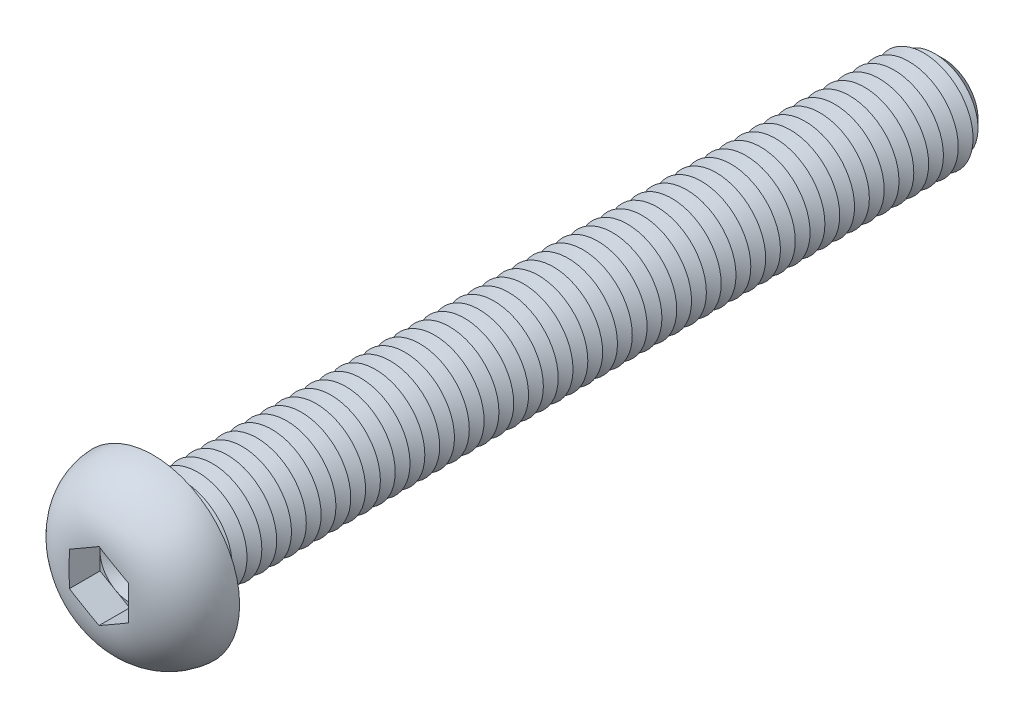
SolidWorks part; units mm, degrees
ref_plane "Front Plane" through (0, 0, 0) normal (0, 0, 1) x (1, 0, 0)
ref_plane "Top Plane" through (0, 0, 0) normal (0, 1, 0) x (1, 0, 0)
ref_plane "Right Plane" through (0, 0, 0) normal (1, 0, 0) x (0, 0, -1)
sketch "Sketch1" plane through (0, 0, 0) normal (1, 0, 0) x (0, 0, -1)
  line L0 (-47.9342, 0) -> (60.3146, 0) construction
sketch "Sketch2" plane through (0, 0, 0) normal (1, 0, 0) x (0, 0, -1)
  line L0 (0, 0) -> (-5.5, 0)
  line L1 (-47.9342, 0) -> (60.3146, 0) construction
  line L2 (-5.5, 0) -> (-5.5, 2.9578)
  line L3 (0, 8.75) -> (0, 0)
  arc A0 (-5.5, 2.9578) -> (0, 8.75) centre (0.3, 2.9578) cw
  dimension "D1" = 5.8
  dimension "D2" = 5.5
  dimension "D3" = 8.75
revolve "Revolve1" add sketch "Sketch2" angle 360 about L0
sketch "Sketch3" plane through (0, 0, 5.5) normal (0, 0, 1) x (1, 0, 0)
  line L1 (0, 3.4641) -> (-3, 1.7321)
  line L2 (-3, 1.7321) -> (-3, -1.7321)
  line L3 (-3, -1.7321) -> (0, -3.4641)
  line L4 (0, -3.4641) -> (3, -1.7321)
  line L5 (3, -1.7321) -> (3, 1.7321)
  line L6 (3, 1.7321) -> (0, 3.4641)
  circle A0 centre (0, 0) radius 3 construction
  dimension "D1" = 6
extrude "Cut-Extrude1" cut sketch "Sketch3" against normal blind 3.12
sketch "Sketch4" plane through (0, 0, 0) normal (0, 0, -1) x (-1, 0, 0)
  circle A0 centre (0, 0) radius 5
  dimension "D1" = 10
extrude "Boss-Extrude1" add sketch "Sketch4" along normal blind 80
chamfer "Chamfer1" distance 1.5 angle 45 1 edges at (-5, 0, -80)
sketch "Sketch5" plane through (0, 0, 0) normal (1, 0, 0) x (0, 0, -1)
  line L0 (1.5, 5) -> (3, 5)
  line L1 (78.5, 5) -> (0, 5) construction
  line L2 (3, 5) -> (2.25, 3.701)
  line L3 (2.25, 3.701) -> (1.5, 5)
  line L4 (0, -8.75) -> (0, 8.75) construction
  line L5 (78.5, 5) -> (0, 5) construction
  dimension "D1" = 1.5
  dimension "D2" = 1.5
revolve "Cut-Revolve1" cut sketch "Sketch5" angle 360 about L0
pattern_linear "LPattern1" count 52 spacing 1.5 along (0, 0, -1) of "Cut-Revolve1"
fillet "Fillet2" radius 0.6 1 edges at (5, 0, 0)
sketch "Sketch6" plane through (0, 0, 2.38) normal (0, 0, 1) x (1, 0, 0)
  line L0 (0, -3.4641) -> (3, -1.7321) construction
  circle A0 centre (0, 0) radius 3
extrude "Cut-Extrude2" cut sketch "Sketch6" against normal through all draft 60
